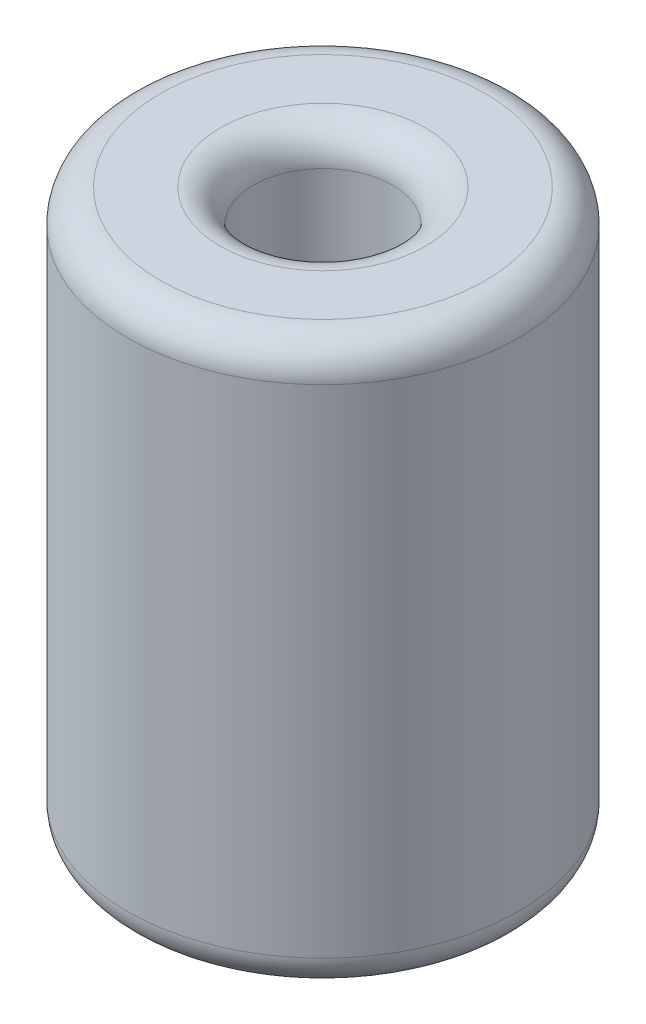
SolidWorks part; units mm, degrees
ref_plane "Front Plane" through (0, 0, 0) normal (0, 0, 1) x (1, 0, 0)
ref_plane "Top Plane" through (0, 0, 0) normal (0, 1, 0) x (1, 0, 0)
ref_plane "Right Plane" through (0, 0, 0) normal (1, 0, 0) x (0, 0, -1)
sketch "Sketch1" plane through (0, 0, 0) normal (0, 1, 0) x (1, 0, 0)
  circle A0 centre (0, 0) radius 2.95
  dimension "D1" = 5.9
extrude "Boss-Extrude1" add sketch "Sketch1" along normal mid plane 8.5
fillet "Fillet1" radius 0.5 2 edges at (0, -4.25, 2.95) (0, 4.25, 2.95)
ref_plane "Plane1" through (-1.5, 0, 0) normal (1, 0, 0) x (0, 0, -1)
sketch "Sketch2" plane through (-1.5, 0, 0) normal (1, 0, 0) x (0, 0, -1)
  circle A0 centre (0, 0) radius 1.5
  dimension "D1" = 3
extrude "Cut-Extrude1" cut sketch "Sketch2" against normal through all
sketch "Sketch3" plane through (0, 4.25, 0) normal (0, 1, 0) x (1, 0, 0)
  circle A0 centre (0, 0) radius 1.05
  dimension "D1" = 2.1
extrude "Cut-Extrude2" cut sketch "Sketch3" against normal through all
fillet "Fillet2" radius 0.5 2 edges at (0, -4.25, 1.05) (0, 4.25, 1.05)
